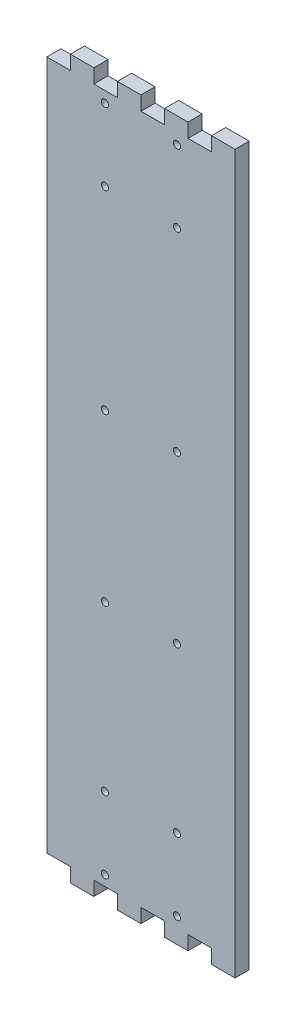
SolidWorks part; units mm, degrees
ref_plane "Piano frontale" through (0, 0, 0) normal (0, 0, 1) x (1, 0, 0)
ref_plane "Piano superiore" through (0, 0, 0) normal (0, 1, 0) x (1, 0, 0)
ref_plane "Piano destro" through (0, 0, 0) normal (1, 0, 0) x (0, 0, -1)
sketch "Schizzo1" plane through (0, 0, 0) normal (0, 0, 1) x (1, 0, 0)
  line L4 (-40, 143) -> (-40, -150)
  line L43 (40, 0) -> (-40, 0) construction
  line L44 (-20, -156) -> (-30, -156)
  line L45 (0, -156) -> (-10, -156)
  line L46 (20, -156) -> (10, -156)
  line L47 (30, -156) -> (30, -150)
  line L48 (30, -150) -> (20, -150)
  line L49 (20, -156) -> (20, -150)
  line L50 (10, -156) -> (10, -150)
  line L51 (10, -150) -> (0, -150)
  line L52 (0, -156) -> (0, -150)
  line L53 (-10, -156) -> (-10, -150)
  line L54 (-10, -150) -> (-20, -150)
  line L55 (-20, -156) -> (-20, -150)
  line L56 (-30, -156) -> (-30, -150)
  line L57 (-30, -150) -> (-40, -150)
  line L58 (-20, 149) -> (-30, 149)
  line L59 (20, 149) -> (10, 149)
  line L60 (-30, 143) -> (-40, 143)
  line L61 (-30, 149) -> (-30, 143)
  line L62 (-10, 143) -> (-20, 143)
  line L63 (-20, 149) -> (-20, 143)
  line L64 (-10, 149) -> (-10, 143)
  line L65 (10, 143) -> (0, 143)
  line L66 (0, 149) -> (0, 143)
  line L67 (10, 149) -> (10, 143)
  line L68 (20, 149) -> (20, 143)
  line L69 (30, 143) -> (20, 143)
  line L70 (30, 149) -> (30, 143)
  line L71 (0, 149) -> (-10, 149)
  line L72 (40, -156) -> (30, -156)
  line L73 (40, 149) -> (40, -156)
  line L74 (40, 149) -> (30, 149)
  dimension "D1" = 305
  dimension "D2" = 6
  dimension "D3" = 6
extrude "Estrusione-Estrusione1" add sketch "Schizzo1" along normal blind 6
extrude "Cut-Extrude1" cut sketch "Sketch1" against normal blind 10
sketch "Sketch1" plane through (46, 142.5453, 6) normal (0, 0, 1) x (0, 1, 0)
  circle A0 centre (-288.1786, 61.3) radius 1.5
  circle A1 centre (-257.5786, 61.3) radius 1.5
  circle A2 centre (-288.1786, 30.7) radius 1.5
  circle A3 centre (-257.5786, 30.7) radius 1.5
  circle A4 centre (-4.2453, 61.3) radius 1.5
  circle A5 centre (-34.8453, 61.3) radius 1.5
  circle A6 centre (-34.8453, 30.7) radius 1.5
  circle A7 centre (-4.2453, 30.7) radius 1.5
  circle A8 centre (-187.8453, 61.3) radius 1.5
  circle A9 centre (-187.8453, 30.7) radius 1.5
  circle A10 centre (-117.2453, 30.7) radius 1.5
  circle A11 centre (-117.2453, 61.3) radius 1.5
